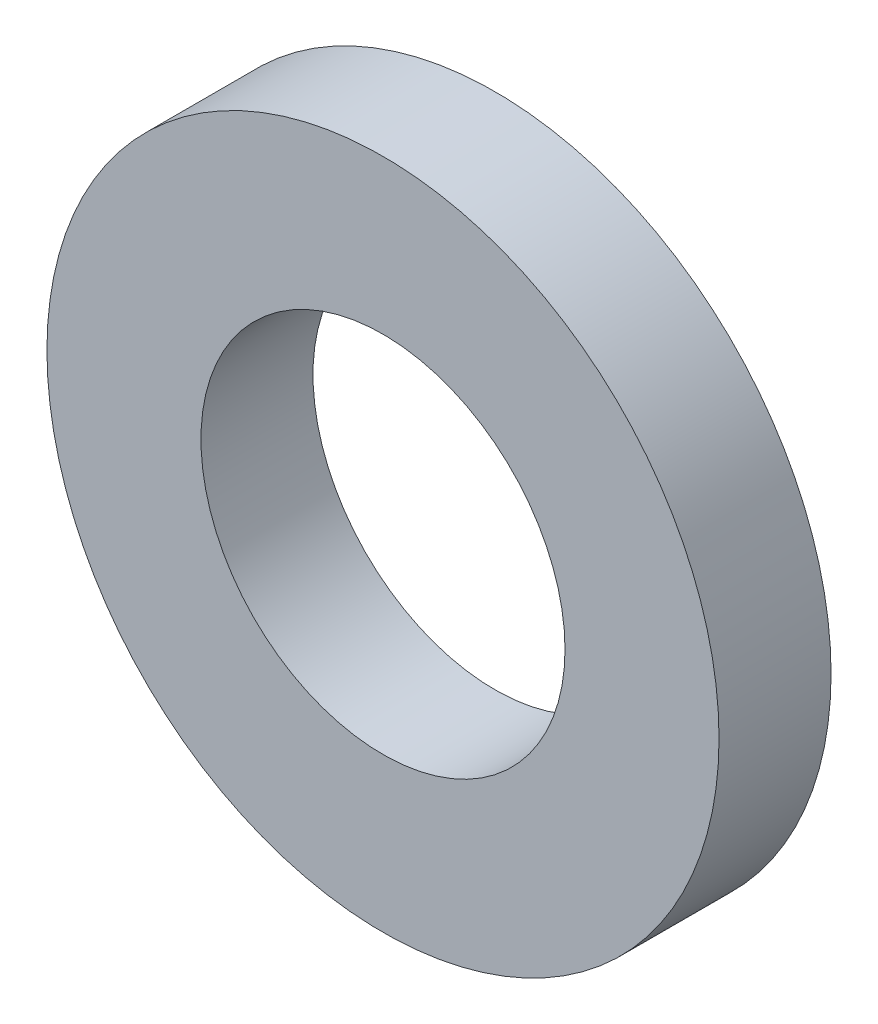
SolidWorks part; units mm, degrees
ref_plane "Front Plane" through (0, 0, 0) normal (0, 0, 1) x (1, 0, 0)
ref_plane "Top Plane" through (0, 0, 0) normal (0, 1, 0) x (1, 0, 0)
ref_plane "Right Plane" through (0, 0, 0) normal (1, 0, 0) x (0, 0, -1)
sketch "Sketch1" plane through (0, 0, 0) normal (0, 0, 1) x (1, 0, 0)
  circle A0 centre (0, 0) radius 20.6375
  circle A1 centre (0, 0) radius 38.1
  dimension "D1" = 76.2
  dimension "D2" = 41.275
extrude "Extrude1" add sketch "Sketch1" along normal blind 12.7
